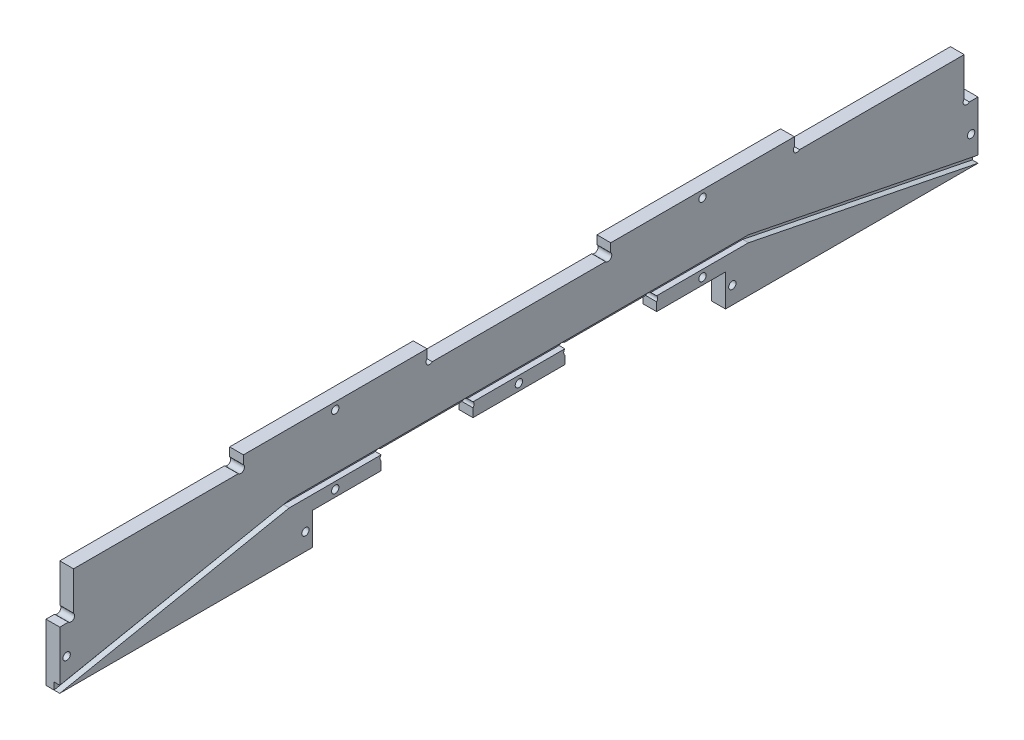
SolidWorks part; units mm, degrees
ref_plane "Plan de face" through (0, 0, 0) normal (0, 0, 1) x (1, 0, 0)
ref_plane "Plan de dessus" through (0, 0, 0) normal (0, 1, 0) x (1, 0, 0)
ref_plane "Plan de droite" through (0, 0, 0) normal (1, 0, 0) x (0, 0, -1)
sketch "Esquisse1" plane through (0, 0, 0) normal (1, 0, 0) x (0, 0, -1)
  line L0 (243.8929, 0) -> (-218.5113, 0) construction
  line L1 (0, -27.5243) -> (0, 84.8201) construction
  line L2 (243.8929, 50) -> (-218.5113, 50) construction
  line L3 (200, 95.6875) -> (200, -8.5433) construction
  line L4 (-200, -8.5433) -> (-200, 95.6875) construction
  line L5 (217.6455, 44) -> (-56.3075, 44) construction
  line L6 (40, 64.6954) -> (40, 41.7955) construction
  line L7 (80, 73.9528) -> (80, 41.7955) construction
  line L8 (88.8387, 47) -> (77.196, 47) construction
  line L9 (40, 44) -> (28.0412, 55.9588) construction
  line L10 (40, 46.2627) -> (40, 50)
  line L11 (40, 50) -> (120, 50)
  line L12 (120, 50) -> (120, 46.2627)
  line L13 (-40, 50) -> (-120, 50)
  line L14 (-120, 50) -> (-120, 46.2627)
  line L15 (-40, 46.2627) -> (-40, 50)
  line L16 (226.9484, 25) -> (191.089, 25) construction
  line L17 (194, 60.1452) -> (194, 18.5483) construction
  line L18 (217.6455, 12.5) -> (191.089, 12.5) construction
  line L19 (197, 19.7403) -> (197, 10.8885) construction
  line L20 (194, 25) -> (204.7696, 35.7696) construction
  line L21 (122.2627, 44) -> (194, 44)
  line L22 (194, 44) -> (194, 27.2627)
  line L23 (196.2627, 25) -> (200, 25)
  line L24 (200, 25) -> (200, 0)
  line L25 (-200, 25) -> (-200, 0)
  line L26 (-196.2627, 25) -> (-200, 25)
  line L27 (-194, 44) -> (-194, 27.2627)
  line L28 (-122.2627, 44) -> (-194, 44)
  line L29 (-37.7373, 44) -> (37.7373, 44)
  line L30 (-200, 0) -> (-90, 0)
  line L31 (90, -14.6257) -> (90, 16.4415) construction
  line L32 (-218.5113, 14) -> (97.6558, 14) construction
  line L33 (90, 14) -> (90, 0)
  line L34 (-90, 14) -> (-90, 0)
  line L35 (-90, 14) -> (-60, 14)
  line L36 (90, 0) -> (200, 0)
  line L37 (96, -27.5243) -> (96, 30.7288) construction
  line L38 (-3.2799, 17) -> (86, 17) construction
  line L39 (-11.5356, 20) -> (98.8063, 20) construction
  line L40 (93, 30.7288) -> (93, 4.6485) construction
  line L41 (96.8887, 7.5) -> (77.196, 7.5) construction
  line L42 (40, 30.7288) -> (40, 11) construction
  line L43 (20, 25) -> (20, 4.6485) construction
  line L44 (20, 20) -> (33.7905, 6.2095) construction
  line L45 (60, 17.7373) -> (60, 14)
  line L46 (20, 17.7373) -> (20, 14)
  line L47 (22.2627, 20) -> (57.7373, 20)
  line L48 (60, 14) -> (90, 14)
  line L49 (-22.2627, 20) -> (-57.7373, 20)
  line L50 (-20, 17.7373) -> (-20, 14)
  line L51 (-60, 17.7373) -> (-60, 14)
  line L52 (-20, 14) -> (20, 14)
  arc A0 (37.7373, 44) -> (40, 46.2627) centre (38.8686, 45.1314) ccw
  circle A1 centre (80, 47) radius 1.6
  arc A2 (122.2627, 44) -> (120, 46.2627) centre (121.1314, 45.1314) cw
  arc A3 (-122.2627, 44) -> (-120, 46.2627) centre (-121.1314, 45.1314) ccw
  arc A4 (-37.7373, 44) -> (-40, 46.2627) centre (-38.8686, 45.1314) cw
  circle A5 centre (-80, 47) radius 1.6
  arc A6 (194, 27.2627) -> (196.2627, 25) centre (195.1314, 26.1314) ccw
  circle A7 centre (197, 12.5) radius 1.6
  arc A8 (-194, 27.2627) -> (-196.2627, 25) centre (-195.1314, 26.1314) cw
  circle A9 centre (-197, 12.5) radius 1.6
  circle A10 centre (0, 17) radius 1.6
  arc A11 (57.7373, 20) -> (60, 17.7373) centre (58.8686, 18.8686) cw
  circle A12 centre (93, 7.5) radius 1.6
  circle A13 centre (-93, 7.5) radius 1.6
  arc A14 (22.2627, 20) -> (20, 17.7373) centre (21.1314, 18.8686) ccw
  circle A15 centre (80, 17) radius 1.6
  arc A16 (-22.2627, 20) -> (-20, 17.7373) centre (-21.1314, 18.8686) cw
  arc A17 (-57.7373, 20) -> (-60, 17.7373) centre (-58.8686, 18.8686) ccw
  circle A18 centre (-80, 17) radius 1.6
  point P77 (-90, 14)
  point P80 (90, 14)
  dimension "D9" = 6
  dimension "D14" = 14
  dimension "D16" = 40
  dimension "D22" = 20
  dimension "D23" = 45
  dimension "D1" = 50
  dimension "D2" = 200
  dimension "D3" = 400
  dimension "D4" = 80
  dimension "D5" = 40
  dimension "D6" = 6
  dimension "D7" = 3
  dimension "D8" = 45
  dimension "D10" = 25
  dimension "D11" = 12.5
  dimension "D12" = 45
  dimension "D13" = 3
  dimension "D15" = 90
  dimension "D17" = 6
  dimension "D18" = 3
  dimension "D19" = 20
  dimension "D20" = 7.5
  dimension "D21" = 3
extrude "Boss.-Extru.1" add sketch "Esquisse1" along normal blind 6
sketch "Esquisse2" plane through (6, 0, 0) normal (1, 0, 0) x (0, 0, -1)
  line L0 (0, -10.3988) -> (0, 70.2166) construction
  line L1 (100, -13.5339) -> (100, 89.4747) construction
  line L2 (-100, -10.3988) -> (-100, 89.4747) construction
  line L3 (237.4113, 0) -> (-207.765, 0) construction
  line L4 (237.4113, 20) -> (-130.7325, 20) construction
  line L5 (200, -13.5339) -> (200, 68.3144) construction
  line L6 (100, 20) -> (200, 0) construction
  line L7 (237.4113, 23) -> (-104.4525, 23) construction
  line L8 (78.9488, 27.2697) -> (198.0796, 3.4435) construction
  line L9 (100, 20) -> (200, 0)
  line L10 (100, 23) -> (200, 3.0594)
  line L11 (200, 3.0594) -> (200, 0)
  line L12 (-100, 20) -> (-200, 0)
  line L13 (-100, 23) -> (-200, 3.0594)
  line L14 (-200, 3.0594) -> (-200, 0)
  line L15 (-100, 23) -> (100, 23)
  line L16 (-100, 20) -> (100, 20)
  line L17 (200, 0) -> (200, 25) construction
  dimension "D1" = 100
  dimension "D2" = 200
  dimension "D3" = 20
  dimension "D4" = 3
  dimension "D5" = 3
extrude "Enlèv. mat.-Extru.1" cut sketch "Esquisse2" against normal blind 2.5
